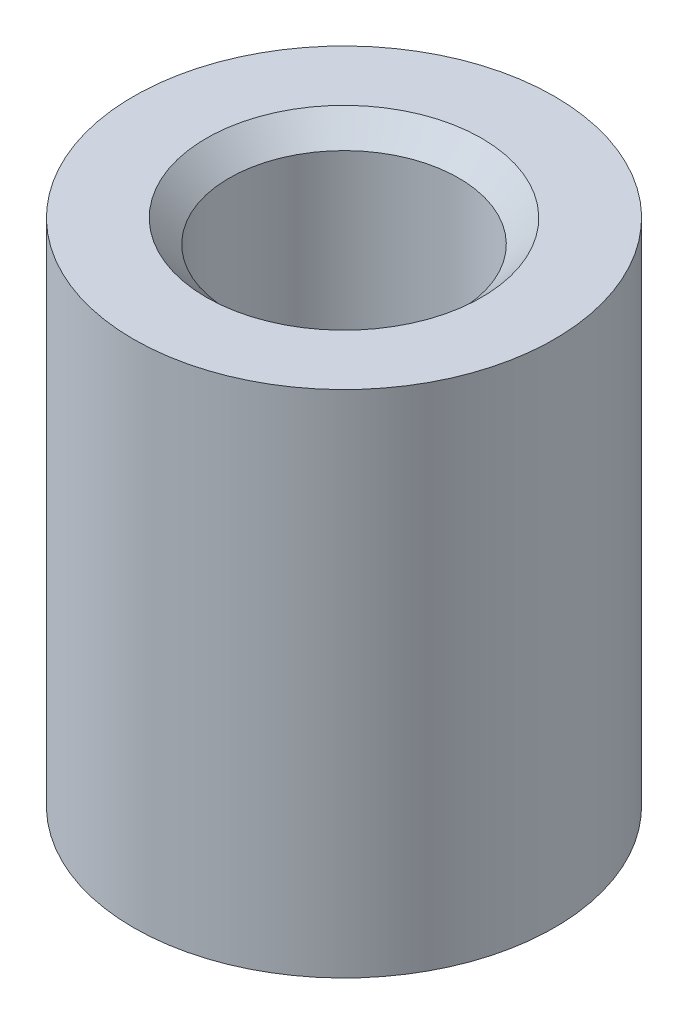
SolidWorks part; units mm, degrees
ref_plane "Front Plane" through (0, 0, 0) normal (0, 0, 1) x (1, 0, 0)
ref_plane "Top Plane" through (0, 0, 0) normal (0, 1, 0) x (1, 0, 0)
ref_plane "Right Plane" through (0, 0, 0) normal (1, 0, 0) x (0, 0, -1)
sketch "Sketch1" plane through (0, 0, 0) normal (0, 1, 0) x (1, 0, 0)
  circle A0 centre (0, 0) radius 3.81
  circle A1 centre (0, 0) radius 6.985
  dimension "D1" = 7.62
  dimension "D2" = 3.175
extrude "Boss-Extrude1" add sketch "Sketch1" along normal blind 16.9164
chamfer "Chamfer1" distance 0.762 angle 45 2 edges at (0, 0, 3.81) (0, 16.9164, 3.81)
